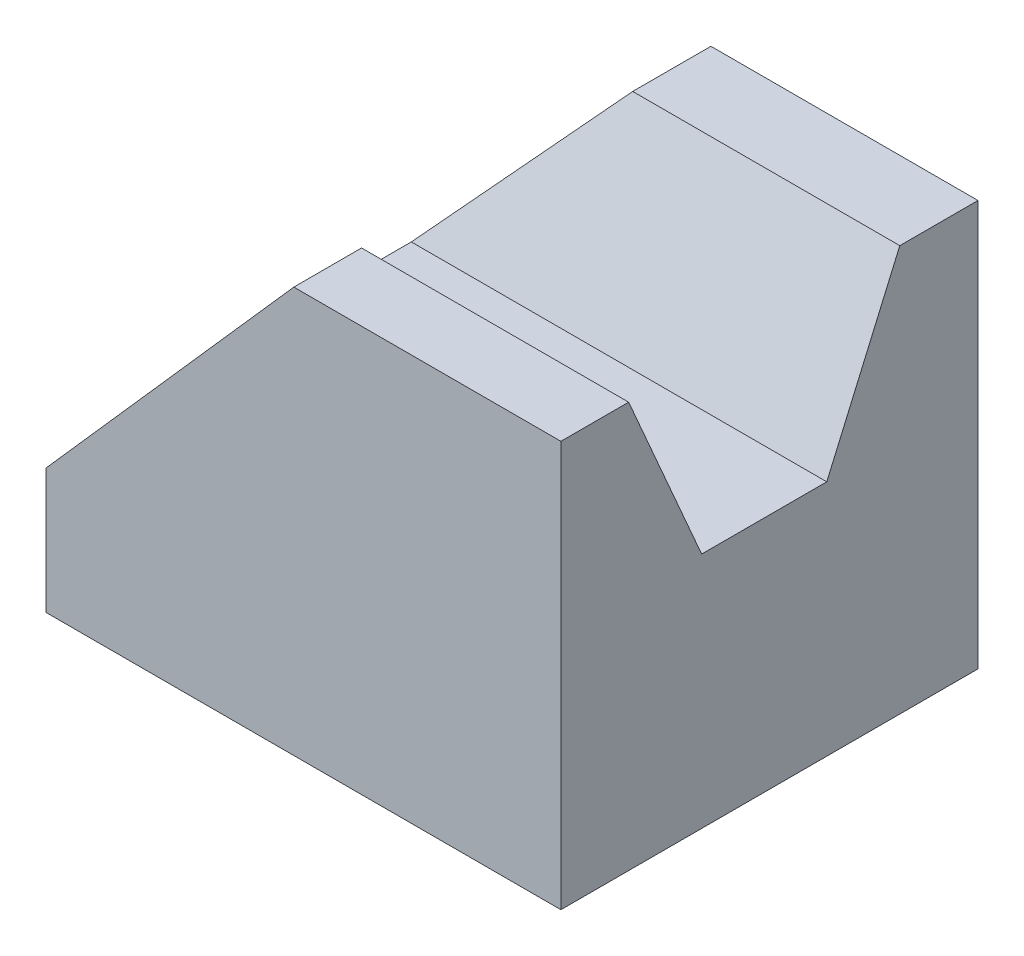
SolidWorks part; units mm, degrees
ref_plane "前视基准面" through (0, 0, 0) normal (0, 0, 1) x (1, 0, 0)
ref_plane "上视基准面" through (0, 0, 0) normal (0, 1, 0) x (1, 0, 0)
ref_plane "右视基准面" through (0, 0, 0) normal (1, 0, 0) x (0, 0, -1)
sketch "草图1" plane through (0, 0, 0) normal (0, 0, 1) x (1, 0, 0)
  line L1 (-24.6886, -19.4518) -> (24.6886, -19.4518)
  line L2 (-24.6886, -19.4518) -> (-24.6886, 19.4518)
  line L3 (-24.6886, 19.4518) -> (24.6886, 19.4518)
  line L4 (24.6886, -19.4518) -> (24.6886, 19.4518)
  line L5 (-24.6886, -19.4518) -> (24.6886, 19.4518) construction
  line L6 (-24.6886, 19.4518) -> (24.6886, -19.4518) construction
  point P0 (0, 0)
extrude "凸台-拉伸1" add sketch "草图1" along normal blind 40
sketch "草图2" plane through (0, 0, 0) normal (0, 0, 1) x (1, 0, 0)
  line L0 (-0.9247, 19.4518) -> (-24.6886, -7.456)
  line L1 (24.6886, 19.4518) -> (-24.6886, 19.4518) construction
  line L2 (-24.6886, 19.4518) -> (-24.6886, -19.4518) construction
  line L3 (-24.6886, -7.456) -> (-24.6886, 19.4518)
  line L4 (-24.6886, 19.4518) -> (-0.9247, 19.4518)
extrude "切除-拉伸1" cut sketch "草图2" along normal through all
sketch "草图3" plane through (0, 0, 0) normal (1, 0, 0) x (0, 0, -1)
  line L0 (-20.5015, 25.5842) -> (-20.5015, -28.6965) construction
  line L1 (-33.5015, 19.4518) -> (-26.5015, 3.3372)
  line L2 (-40, 19.4518) -> (0, 19.4518) construction
  line L3 (-26.5015, 3.3372) -> (-14.5015, 3.3372)
  line L4 (-14.5015, 3.3372) -> (-7.5015, 19.4518)
  line L5 (-7.5015, 19.4518) -> (-33.5015, 19.4518)
  dimension "D1" = 26
  dimension "D2" = 13
  dimension "D3" = 12
  dimension "D4" = 6
extrude "切除-拉伸2" cut sketch "草图3" along normal through all and the other way through all
